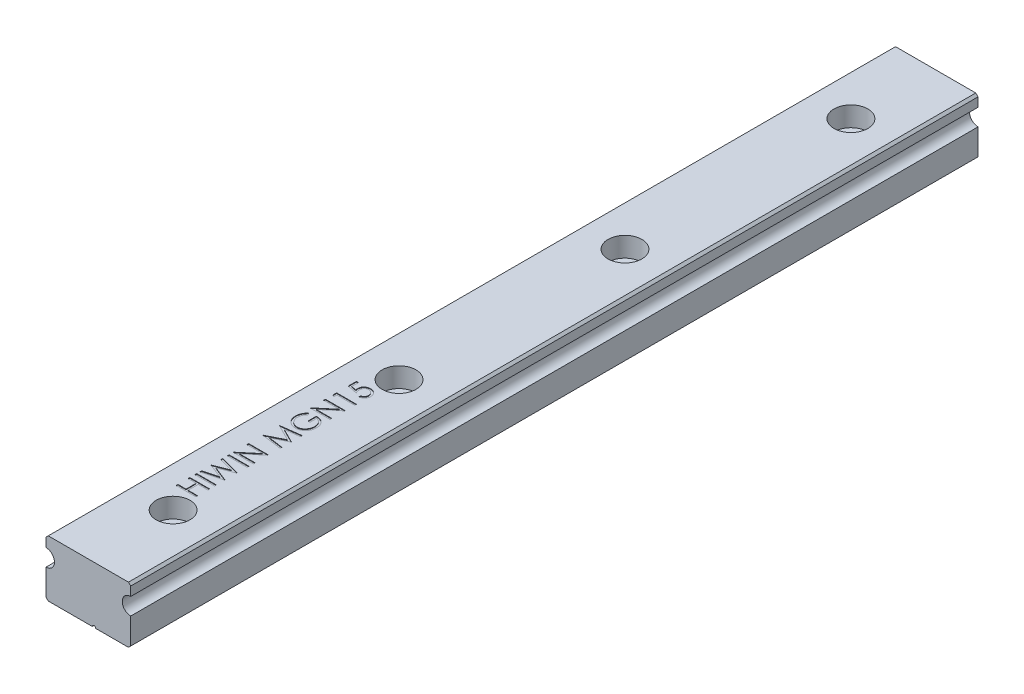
SolidWorks part; units mm, degrees
ref_plane "前视基准面" through (0, 0, 0) normal (0, 0, 1) x (1, 0, 0)
ref_plane "上视基准面" through (0, 0, 0) normal (0, 1, 0) x (1, 0, 0)
ref_plane "右视基准面" through (0, 0, 0) normal (1, 0, 0) x (0, 0, -1)
sketch "草图1" plane through (0, 0, 0) normal (0, 0, 1) x (1, 0, 0)
  line L12 (-7.1, 0) -> (0.7, 0)
  line L13 (-7.5, 5) -> (-7.5, 0.4)
  line L14 (-7.5, 0.4) -> (-7.1, 0)
  line L15 (7.1, 10) -> (-7.1, 10)
  line L16 (7.1, 0) -> (7.5, 0.4)
  line L17 (-7.5, 9.6) -> (-7.5, 8)
  line L18 (1.3, 0) -> (7.1, 0)
  line L19 (-7.1, 10) -> (-7.5, 9.6)
  line L20 (0, 10) -> (0, 0) construction
  line L21 (7.5, 8) -> (7.5, 9.6)
  line L22 (7.5, 0.4) -> (7.5, 5)
  line L23 (7.5, 9.6) -> (7.1, 10)
  arc A3 (7.5, 8) -> (7.5, 5) centre (7.5, 6.5) ccw
  arc A4 (1.3, 0) -> (0.7, 0) centre (1, 0) ccw
  arc A5 (-7.5, 5) -> (-7.5, 8) centre (-7.5, 6.5) ccw
extrude "凸台-拉伸1" add sketch "草图1" against normal blind 150
hole_wizard "M3 六角凹头螺钉的柱形沉头孔1" positions "草图3" profile "草图2" counterbore size "M3" standard "ISO"
sketch "草图3" plane through (-0.3705, 10, 7.7776) normal (0, 1, 0) x (-1, 0, 0)
  point P0 (-0.3705, -22.7776)
  dimension "D1" = 15
sketch "草图2" plane through (0, 10, -15) normal (1, 0, 0) x (0, 0, 1)
  line L0 (0, 0) -> (0, 10)
  line L1 (0, 10) -> (1.75, 10)
  line L3 (1.75, 10) -> (1.75, 3.5)
  line L4 (1.75, 3.5) -> (3, 3.5)
  line L5 (3, 3.5) -> (3, 0)
  line L7 (3, 0) -> (0, 0)
  line L11 (0, -6.35) -> (0, 107.95) construction
  dimension "通孔孔直径" = 3.5
  dimension "通孔孔深度" = 10
  dimension "柱形沉头孔直径" = 6
  dimension "柱形沉头孔深度" = 3.5
pattern_linear "阵列(线性)1" count 4 spacing 40 along (0, 0, -1) of "M3 六角凹头螺钉的柱形沉头孔1"
sketch "草图6" plane through (0, 10, 0) normal (0, 1, 0) x (1, 0, 0)
  line L0 (0, 15) -> (0, 55) construction
  text T0 "HIWIN MGN15"
extrude "切除-拉伸1" cut sketch "草图6" against normal blind 0.1
equation "\"D1@凸台-拉伸1\" = 2 * \"D1@草图3\" + \"D3@阵列(线性)1\" *  ( \"D1@阵列(线性)1\"  - 1) "
